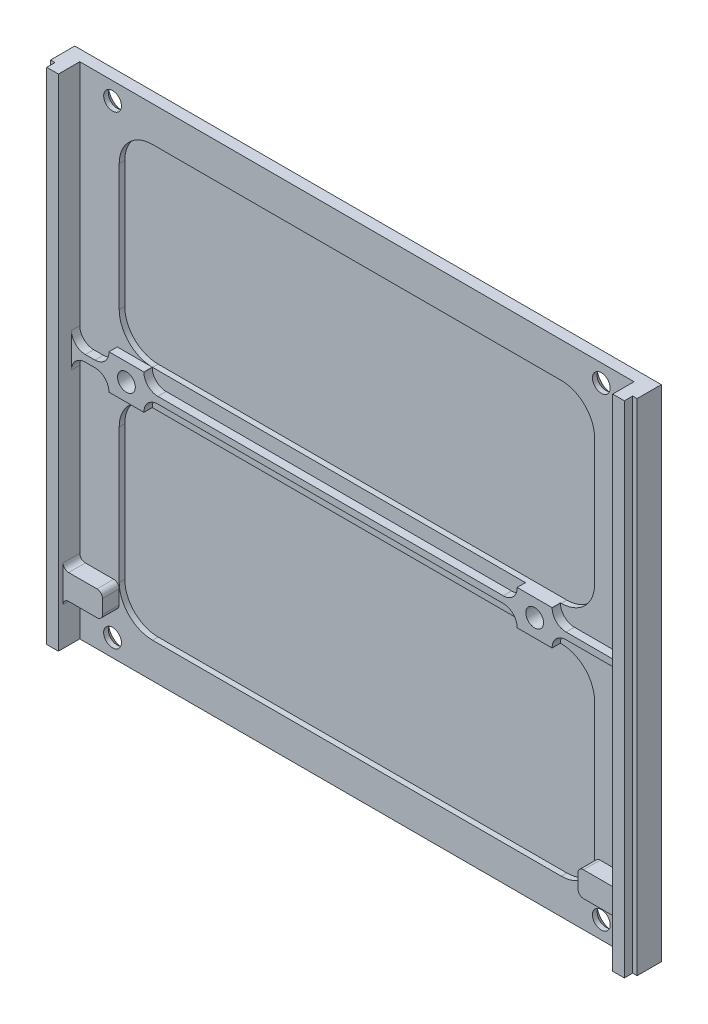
SolidWorks part; units mm, degrees
ref_plane "Front Plane" through (0, 0, 0) normal (0, 0, 1) x (1, 0, 0)
ref_plane "Top Plane" through (0, 0, 0) normal (0, 1, 0) x (1, 0, 0)
ref_plane "Right Plane" through (0, 0, 0) normal (1, 0, 0) x (0, 0, -1)
sketch "Sketch1" plane through (0, 0, 0) normal (0, 0, 1) x (1, 0, 0)
  line L1 (-52.8, -45) -> (52.8, -45)
  line L2 (-52.8, -45) -> (-52.8, 45)
  line L3 (-52.8, 45) -> (52.8, 45)
  line L4 (52.8, -45) -> (52.8, 45)
  line L5 (-52.8, -45) -> (52.8, 45) construction
  line L6 (-52.8, 45) -> (52.8, -45) construction
  point P0 (0, 0)
  dimension "D1" = 90
  dimension "D2" = 105.6
extrude "Plate" add sketch "Sketch1" along normal blind 5.85
sketch "Sketch2" plane through (0, 45, 0) normal (0, 1, 0) x (1, 0, 0)
  line L0 (52.8, -5.85) -> (-52.8, -5.85) construction
  line L1 (-49.9, -2) -> (49.9, -2)
  line L2 (-49.9, -2) -> (-49.9, -5.85)
  line L3 (-49.9, -5.85) -> (49.9, -5.85)
  line L4 (49.9, -2) -> (49.9, -5.85)
  line L5 (0, 0) -> (0, -5.85) construction
  line L6 (52.8, -5.85) -> (52.8, 0) construction
  line L7 (52.8, 0) -> (-52.8, 0) construction
  dimension "D1" = 2.9
  dimension "D2" = 2
extrude "Cut-Extrude1" cut sketch "Sketch2" against normal through all
sketch "Sketch3" plane through (0, 45, 0) normal (0, 1, 0) x (1, 0, 0)
  line L0 (0, 0) -> (0, -5.8) construction
  line L1 (52.8, -5.85) -> (52, -5.85)
  line L2 (52.8, -5.85) -> (52.8, -4.35)
  line L3 (52.8, -4.35) -> (52, -4.35)
  line L4 (52, -5.85) -> (52, -4.35)
  line L5 (-52.8, -5.85) -> (-52, -5.85)
  line L6 (-52.8, -5.85) -> (-52.8, -4.35)
  line L7 (-52.8, -4.35) -> (-52, -4.35)
  line L8 (-52, -5.85) -> (-52, -4.35)
  line L9 (52.8, 0) -> (-52.8, 0) construction
  dimension "D1" = 0.8
  dimension "D2" = 1.5
extrude "Cut-Extrude2" cut sketch "Sketch3" against normal through all
sketch "Sketch4" plane through (0, 0, 2) normal (0, 0, 1) x (1, 0, 0)
  line L0 (-52.8, 5) -> (52.8, 5) construction
  line L1 (-42.8, 37) -> (42.8, 37)
  line L2 (-42.8, 37) -> (-42.8, 8.15)
  line L3 (-42.8, 8.15) -> (42.8, 8.15)
  line L4 (42.8, 37) -> (42.8, 8.15)
  line L5 (-42.8, -37) -> (42.8, -37)
  line L6 (-42.8, -37) -> (-42.8, 1.85)
  line L7 (-42.8, 1.85) -> (42.8, 1.85)
  line L8 (42.8, -37) -> (42.8, 1.85)
  line L9 (-52.8, -45) -> (-52.8, 45) construction
  line L10 (52.8, -45) -> (52.8, 45) construction
  line L11 (49.9, -45) -> (-49.9, -45) construction
  line L12 (49.9, 45) -> (-49.9, 45) construction
  line L13 (0, 0) -> (0, -45) construction
  dimension "D1" = 50
  dimension "D2" = 10
  dimension "D3" = 8
  dimension "D4" = 8
  dimension "D5" = 6.3
extrude "Cut-Extrude3" [suppressed] cut sketch "Sketch4" against normal up to next
sketch "Sketch5" plane through (0, 0, 2) normal (0, 0, 1) x (1, 0, 0)
  line L1 (-43.15, -2.4) -> (-36.85, -2.4)
  line L2 (-43.15, -2.4) -> (-43.15, 0.15)
  line L3 (-43.15, 3.9) -> (-36.85, 3.9)
  line L4 (-36.85, -2.4) -> (-36.85, 0.15)
  line L5 (-43.15, -2.4) -> (-36.85, 3.9) construction
  line L6 (-43.15, 3.9) -> (-36.85, -2.4) construction
  line L8 (30.35, -2.4) -> (36.65, -2.4)
  line L9 (30.35, -2.4) -> (30.35, 0.15)
  line L10 (30.35, 3.9) -> (36.65, 3.9)
  line L11 (36.65, -2.4) -> (36.65, 0.15)
  line L12 (30.35, -2.4) -> (36.65, 3.9) construction
  line L13 (30.35, 3.9) -> (36.65, -2.4) construction
  line L14 (0, 0) -> (0, 45) construction
  line L15 (49.9, 45) -> (-49.9, 45) construction
  line L16 (52, -45) -> (52, 45) construction
  line L17 (-36.85, 1.35) -> (30.35, 1.35)
  line L18 (49.9, -45) -> (-49.9, -45) construction
  line L19 (-36.85, 0.15) -> (30.35, 0.15)
  line L20 (36.65, 1.35) -> (36.65, 3.9)
  line L21 (36.65, 1.35) -> (52, 1.35)
  line L22 (-43.15, 1.35) -> (-43.15, 3.9)
  line L23 (36.65, 0.15) -> (52, 0.15)
  line L24 (52, 1.35) -> (52, 0.15)
  line L25 (-52, -45) -> (-52, 45) construction
  line L26 (-43.15, 1.35) -> (-52, 1.35)
  line L27 (-36.85, 1.35) -> (-36.85, 3.9)
  line L28 (-43.15, 0.15) -> (-52, 0.15)
  line L29 (-52, 1.35) -> (-52, 0.15)
  line L30 (33.5, 0.75) -> (-40, 0.75) construction
  line L31 (30.35, 1.35) -> (30.35, 3.9)
  point P0 (-40, 0.75)
  point P7 (33.5, 0.75)
  dimension "D1" = 6.3
  dimension "D2" = 73.5
  dimension "D3" = 1.2
  dimension "D4" = 40
  dimension "D5" = 6.3
  dimension "D6" = 45.75
extrude "MUX Rib" add sketch "Sketch5" along normal offset from surface (1.5 mm away) 2.35
sketch "Sketch6" [suppressed] plane through (0, 0, 0) normal (0, 0, -1) x (-1, 0, 0)
  line L1 (-41.8, 35) -> (41.8, 35) construction
  line L2 (-43.3, -36.5) -> (43.3, -36.5)
  line L3 (-43.3, -36.5) -> (-43.3, 36.5)
  line L4 (-43.3, 36.5) -> (43.3, 36.5)
  line L5 (43.3, -36.5) -> (43.3, 36.5)
  line L6 (-43.3, -36.5) -> (43.3, 36.5) construction
  line L7 (-43.3, 36.5) -> (43.3, -36.5) construction
  line L8 (41.8, 35) -> (41.8, 10.15) construction
  line L9 (41.8, -35) -> (-41.8, -35) construction
  point P0 (0, 0)
  dimension "D1" = 1.5
  dimension "D2" = 1.5
  dimension "D3" = 1.5
extrude "Sheet Metal Slot" [suppressed] cut sketch "Sketch6" against normal blind 0.8
sketch "Sketch7" plane through (0, 0, 5.85) normal (0, 0, 1) x (1, 0, 0)
  line L0 (0, 0) -> (0, 45) construction
  line L1 (49.9, 45) -> (-49.9, 45) construction
  line L2 (-36.85, 3.9) -> (-43.15, 3.9) construction
  line L3 (-40, 0.75) -> (33.5, 0.75) construction
  line L4 (30.35, 1.35) -> (-36.85, 1.35) construction
  line L5 (-36.85, 0.15) -> (30.35, 0.15) construction
  line L6 (30.35, 3.9) -> (36.65, 3.9) construction
  circle A0 centre (33.5, 0.75) radius 1.6
  circle A1 centre (-40, 0.75) radius 1.6
  point P11 (-40, 3.9)
  point P18 (33.5, 3.9)
  dimension "D1" = 3.2
extrude "Cut-Extrude5" cut sketch "Sketch7" against normal through all
chamfer "Chamfer1" [suppressed] distance 1 angle 45
sketch "Sketch8" plane through (-52, 0, 0) normal (-1, 0, 0) x (0, 0, 1)
  line L0 (5.85, -45) -> (5.85, 45) construction
  line L1 (5.85, 40) -> (3.85, 40)
  line L2 (5.85, 40) -> (5.85, 25)
  line L3 (5.85, 25) -> (3.85, 25)
  line L4 (3.85, 40) -> (3.85, 25)
  line L5 (5.85, 45) -> (4.35, 45) construction
  dimension "D1" = 5
  dimension "D2" = 15
  dimension "D3" = 2
extrude "Cut-Extrude6" [suppressed] cut sketch "Sketch8" against normal through all
sketch "Sketch9" [suppressed] plane through (0, 0, 0.8) normal (0, 0, -1) x (-1, 0, 0)
  line L1 (-41.8, 35) -> (-35.5, 35)
  line L2 (-41.8, 35) -> (-41.8, 28.7)
  line L3 (-41.8, 28.7) -> (-35.5, 28.7)
  line L4 (-35.5, 35) -> (-35.5, 28.7)
  line L5 (41.8, 35) -> (35.5, 35)
  line L6 (41.8, 35) -> (41.8, 28.7)
  line L7 (41.8, 28.7) -> (35.5, 28.7)
  line L8 (35.5, 35) -> (35.5, 28.7)
  line L9 (-41.8, -35) -> (-35.5, -35)
  line L10 (-41.8, -35) -> (-41.8, -28.7)
  line L11 (-41.8, -28.7) -> (-35.5, -28.7)
  line L12 (-35.5, -35) -> (-35.5, -28.7)
  line L13 (41.8, -35) -> (35.5, -35)
  line L14 (41.8, -35) -> (41.8, -28.7)
  line L15 (41.8, -28.7) -> (35.5, -28.7)
  line L16 (35.5, -35) -> (35.5, -28.7)
  dimension "D1" = 6.3
extrude "Boss-Extrude3" [suppressed] add sketch "Sketch9" against normal up to surface (1.2 mm away)
sketch "Sketch10" [suppressed] plane through (0, 0, 0.8) normal (0, 0, -1) x (-1, 0, 0)
  line L1 (-39.4, -32.6) -> (39.4, -32.6) construction
  line L2 (-39.4, -32.6) -> (-39.4, 32.6) construction
  line L3 (-39.4, 32.6) -> (39.4, 32.6) construction
  line L4 (39.4, -32.6) -> (39.4, 32.6) construction
  line L5 (-39.4, -32.6) -> (39.4, 32.6) construction
  line L6 (-39.4, 32.6) -> (39.4, -32.6) construction
  line L8 (-35.5, 28.7) -> (-43.3, 36.5) construction
  circle A0 centre (39.4, 32.6) radius 1.6
  circle A1 centre (-39.4, 32.6) radius 1.6
  circle A2 centre (-39.4, -32.6) radius 1.6
  circle A3 centre (39.4, -32.6) radius 1.6
  point P2 (-39.4, 32.6)
  point P8 (0, 0)
  dimension "D1" = 3.2
extrude "Rivet Holes" [suppressed] cut sketch "Sketch10" against normal up to next
sketch "Sketch11" plane through (0, 0, 0) normal (0, 0, -1) x (-1, 0, 0)
  line L1 (-44, -41.85) -> (44, -41.85) construction
  line L2 (-44, -41.85) -> (-44, 41.85) construction
  line L3 (-44, 41.85) -> (44, 41.85) construction
  line L4 (44, -41.85) -> (44, 41.85) construction
  line L5 (-44, -41.85) -> (44, 41.85) construction
  line L6 (-44, 41.85) -> (44, -41.85) construction
  line L7 (-52.8, 45) -> (52.8, 45) construction
  line L10 (-52, -45) -> (-52, 45) construction
  circle A0 centre (44, 41.85) radius 1.6
  circle A1 centre (44, -41.85) radius 1.6
  circle A2 centre (-44, -41.85) radius 1.6
  circle A3 centre (-44, 41.85) radius 1.6
  point P0 (0, 0)
  dimension "D1" = 3.2
  dimension "D2" = 8
  dimension "D3" = 3.15
extrude "Screw to Top & Bottom" cut sketch "Sketch11" against normal through all
fillet "Fillet1" [suppressed] radius 3.5
fillet "Fillet2" [suppressed] radius 3
sketch "Sketch12" plane through (0, 0, 2) normal (0, 0, 1) x (1, 0, 0)
  line L0 (36.65, -2.4) -> (30.35, -2.4) construction
  line L1 (-42.8, 3.9) -> (42.8, 3.9)
  line L2 (-42.8, 3.9) -> (-42.8, 38.65)
  line L3 (-42.8, 38.65) -> (42.8, 38.65)
  line L4 (42.8, 3.9) -> (42.8, 38.65)
  line L5 (-42.8, 3.9) -> (42.8, 38.65) construction
  line L6 (-42.8, 38.65) -> (42.8, 3.9) construction
  line L7 (-42.8, -38.65) -> (42.8, -38.65)
  line L8 (-42.8, -38.65) -> (-42.8, -2.4)
  line L9 (-42.8, -2.4) -> (42.8, -2.4)
  line L10 (42.8, -38.65) -> (42.8, -2.4)
  line L11 (-42.8, -38.65) -> (42.8, -2.4) construction
  line L12 (-42.8, -2.4) -> (42.8, -38.65) construction
  line L13 (36.65, 3.9) -> (30.35, 3.9) construction
  line L15 (0, 21.275) -> (0, -20.525) construction
  line L21 (49.9, 45) -> (-49.9, 45) construction
  line L22 (52.8, -45) -> (52.8, 45) construction
  line L23 (49.9, -45) -> (-49.9, -45) construction
  point P0 (0, 21.275)
  point P5 (0, -20.525)
  dimension "D1" = 6.35
  dimension "D2" = 10
  dimension "D3" = 6.35
extrude "Cut-Extrude7" cut sketch "Sketch12" against normal offset from surface (1 mm away) 1
fillet "Fillet3" radius 6 8 edges at (42.8, 3.9, 1.5) (42.8, -2.4, 1.5) (-42.8, -2.4, 1.5) (-42.8, 3.9, 1.5) (-42.8, -38.65, 1.5) (42.8, -38.65, 1.5) (42.8, 38.65, 1.5) (-42.8, 38.65, 1.5)
fillet "Fillet6" radius 2.5 12 edges at (-49.9, 1.35, 2.75) (-36.85, 0.15, 2.75) (-43.15, 0.15, 2.75) (-43.15, 1.35, 2.75) (-36.85, 1.35, 2.75) (30.35, 1.35, 2.75) (30.35, 0.15, 2.75) (36.65, 1.35, 2.75) (36.65, 0.15, 2.75) (49.9, 0.15, 2.75) (-49.9, 0.15, 2.75) (49.9, 1.35, 2.75)
sketch "Sketch13" plane through (0, 0, 1) normal (0, 0, 1) x (1, 0, 0)
  line L0 (-36.8, 3.9) -> (36.8, 3.9) construction
  line L1 (42.8, 9.9) -> (42.8, 32.65) construction
  line L2 (36.8, 38.65) -> (-36.8, 38.65) construction
  line L3 (-42.8, 32.65) -> (-42.8, 9.9) construction
  line L4 (42.8, -32.65) -> (42.8, -8.4) construction
  line L5 (36.8, -2.4) -> (-36.8, -2.4) construction
  line L6 (-42.8, -8.4) -> (-42.8, -32.65) construction
  line L7 (-36.8, -38.65) -> (36.8, -38.65) construction
  line L8 (-36.8, 3.9) -> (36.8, 3.9)
  line L9 (42.8, 9.9) -> (42.8, 32.65)
  line L10 (36.8, 38.65) -> (-36.8, 38.65)
  line L11 (-42.8, 32.65) -> (-42.8, 9.9)
  line L12 (42.8, -32.65) -> (42.8, -8.4)
  line L13 (36.8, -2.4) -> (-36.8, -2.4)
  line L14 (-42.8, -8.4) -> (-42.8, -32.65)
  line L15 (-36.8, -38.65) -> (36.8, -38.65)
  arc A0 (36.8, 3.9) -> (42.8, 9.9) centre (36.8, 9.9) ccw construction
  arc A1 (42.8, 32.65) -> (36.8, 38.65) centre (36.8, 32.65) ccw construction
  arc A2 (-36.8, 38.65) -> (-42.8, 32.65) centre (-36.8, 32.65) ccw construction
  arc A3 (-42.8, 9.9) -> (-36.8, 3.9) centre (-36.8, 9.9) ccw construction
  arc A4 (42.8, -8.4) -> (36.8, -2.4) centre (36.8, -8.4) ccw construction
  arc A5 (-36.8, -2.4) -> (-42.8, -8.4) centre (-36.8, -8.4) ccw construction
  arc A6 (-42.8, -32.65) -> (-36.8, -38.65) centre (-36.8, -32.65) ccw construction
  arc A7 (36.8, -38.65) -> (42.8, -32.65) centre (36.8, -32.65) ccw construction
  arc A8 (36.8, 3.9) -> (42.8, 9.9) centre (36.8, 9.9) ccw
  arc A9 (42.8, 32.65) -> (36.8, 38.65) centre (36.8, 32.65) ccw
  arc A10 (-36.8, 38.65) -> (-42.8, 32.65) centre (-36.8, 32.65) ccw
  arc A11 (-42.8, 9.9) -> (-36.8, 3.9) centre (-36.8, 9.9) ccw
  arc A12 (42.8, -8.4) -> (36.8, -2.4) centre (36.8, -8.4) ccw
  arc A13 (-36.8, -2.4) -> (-42.8, -8.4) centre (-36.8, -8.4) ccw
  arc A14 (-42.8, -32.65) -> (-36.8, -38.65) centre (-36.8, -32.65) ccw
  arc A15 (36.8, -38.65) -> (42.8, -32.65) centre (36.8, -32.65) ccw
extrude "3D Print Remove Section" [suppressed] cut sketch "Sketch13" against normal through all
hole_wizard "CSK for M2.5 Flat Head Machine Screw1" positions "Sketch15" profile "Sketch14" countersink size "M2.5" standard "ANSI Metric"
sketch "Sketch15" plane through (0, 0, 0) normal (0, 0, -1) x (-1, 0, 0)
  point P0 (44, -41.85)
  point P3 (-44, -41.85)
  point P6 (44, 41.85)
  point P9 (-44, 41.85)
sketch "Sketch14" plane through (-44, -41.85, 0) normal (1, 0, 0) x (0, 1, 0)
  line L0 (0, 0) -> (0, 5.85)
  line L1 (0, 5.85) -> (1.45, 5.85)
  line L2 (1.45, 5.85) -> (1.45, 1.3)
  line L3 (1.45, 1.3) -> (2.75, 0)
  line L5 (2.75, 0) -> (0, 0)
  line L6 (-1.45, 1.3) -> (-2.75, 0) construction
  line L11 (0, -6.35) -> (0, 107.95) construction
  dimension "Thru Hole Dia." = 2.9
  dimension "Thru Hole Depth" = 5.85
  dimension "Near C'Sink Dia." = 5.5
  dimension "Near C'Sink Angle" = 90
hole_wizard "CSK for M2.5 Flat Head Machine Screw2" positions "Sketch17" profile "Sketch16" countersink size "M2.5" standard "ANSI Metric"
sketch "Sketch17" plane through (0, 0, 0) normal (0, 0, -1) x (-1, 0, 0)
  point P0 (-33.5, 0.75)
  point P3 (40, 0.75)
sketch "Sketch16" plane through (33.5, 0.75, 0) normal (1, 0, 0) x (0, 1, 0)
  line L0 (0, 0) -> (0, 5.85)
  line L1 (0, 5.85) -> (1.45, 5.85)
  line L2 (1.45, 5.85) -> (1.45, 1.3)
  line L3 (1.45, 1.3) -> (2.75, 0)
  line L5 (2.75, 0) -> (0, 0)
  line L6 (-1.45, 1.3) -> (-2.75, 0) construction
  line L11 (0, -6.35) -> (0, 107.95) construction
  dimension "Thru Hole Dia." = 2.9
  dimension "Thru Hole Depth" = 5.85
  dimension "Near C'Sink Dia." = 5.5
  dimension "Near C'Sink Angle" = 90
sketch "Sketch18" plane through (0, 0, 2) normal (0, 0, 1) x (1, 0, 0)
  line L0 (49.9, -45) -> (49.9, -2.35) construction
  line L1 (49.9, -37.15) -> (42.8, -37.15)
  line L2 (49.9, -37.15) -> (49.9, -32.65)
  line L3 (49.9, -32.65) -> (42.8, -32.65)
  line L4 (42.8, -37.15) -> (42.8, -32.65)
  line L5 (-49.9, -45) -> (-49.9, -2.35) construction
  line L6 (-49.9, -37.15) -> (-42.8, -37.15)
  line L7 (-49.9, -37.15) -> (-49.9, -32.65)
  line L8 (-49.9, -32.65) -> (-42.8, -32.65)
  line L9 (-42.8, -37.15) -> (-42.8, -32.65)
extrude "Boss-Extrude4" add sketch "Sketch18" along normal blind 3
fillet "Fillet7" radius 1 8 edges at (49.9, -37.15, 3.5) (42.8, -37.15, 3.5) (42.8, -32.65, 3.5) (49.9, -32.65, 3.5) (-49.9, -37.15, 3.5) (-42.8, -37.15, 3.5) (-42.8, -32.65, 3.5) (-49.9, -32.65, 3.5)
